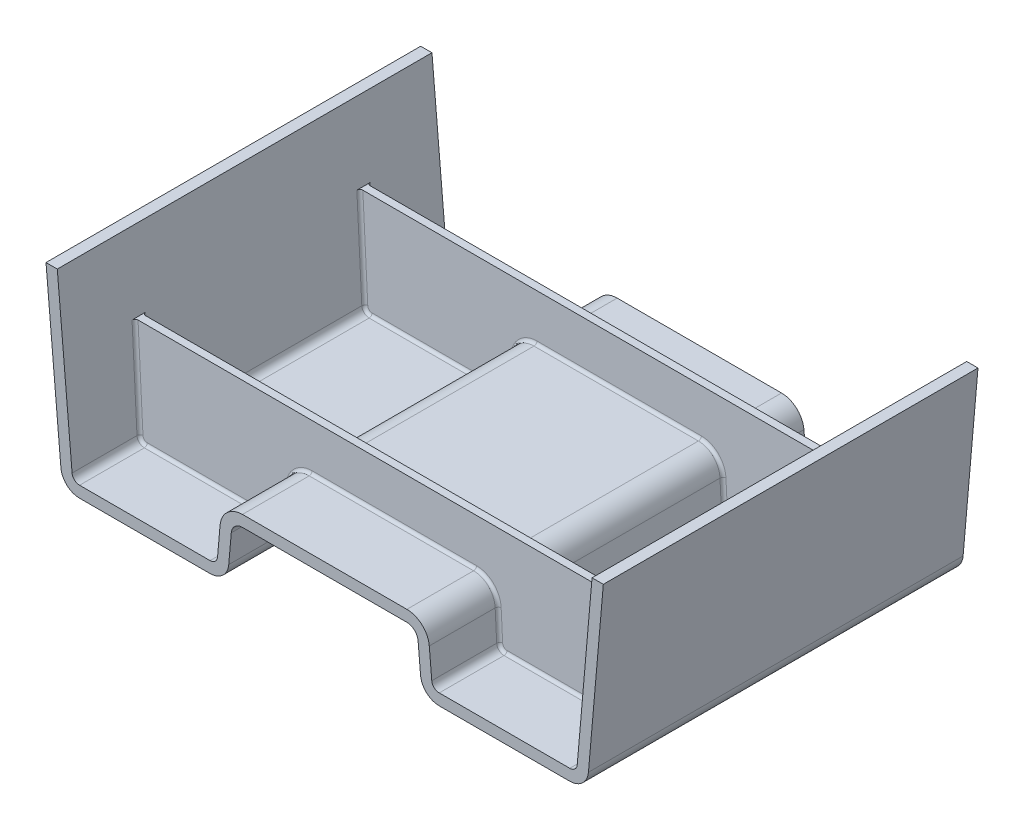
SolidWorks part; units mm, degrees
ref_plane "Front" through (0, 0, 0) normal (0, 0, 1) x (1, 0, 0)
ref_plane "Top" through (0, 0, 0) normal (0, 1, 0) x (1, 0, 0)
ref_plane "Right" through (0, 0, 0) normal (1, 0, 0) x (0, 0, -1)
sketch "Sketch1" plane through (0, 0, 0) normal (0, 0, 1) x (1, 0, 0)
  line L0 (-26, 15) -> (26, 15)
  line L1 (26, 15) -> (26, 0)
  line L2 (26, 0) -> (70, 0)
  line L3 (70, 0) -> (70, 50)
  line L4 (70, 50) -> (-70, 50)
  line L5 (0, 50) -> (0, 0) construction
  line L6 (-70, 0) -> (-70, 50)
  line L7 (-26, 0) -> (-70, 0)
  line L8 (-26, 15) -> (-26, 0)
  point P12 (0, 15)
  dimension "D1" = 50
  dimension "D2" = 140
  dimension "D3" = 52
  dimension "D4" = 15
extrude "Boss-Extrude1" add sketch "Sketch1" along normal mid plane 100
draft "Draft1" type of draft neutral plane draft angle 5 neutral plane "Top" faces to draft 4 parameters "D1"=5
fillet "Fillet1" radius 5 4 edges at (-70, 0, 0) (-26, 0, 0) (26, 0, 0) (70, 0, 0)
fillet "Fillet2" radius 3 2 edges at (24.6877, 15, 0) (-24.6877, 15, 0)
shell "Shell1" thickness 3
ref_plane "Plane1" through (0, 30, 0) normal (0, 1, 0) x (1, 0, 0)
sketch "Sketch2" plane through (0, 30, 0) normal (0, 1, 0) x (1, 0, 0)
  line L0 (-67.4107, -30) -> (67.4107, -30)
  line L1 (-67.4107, 50) -> (-67.4107, -50) construction
  line L2 (67.4107, -50) -> (67.4107, 50) construction
  line L3 (30.5817, -50) -> (65.4183, -50) construction
  dimension "D1" = 20
rib "Rib1" sketch "Sketch2" sketch "Sketch2" thickness 2 extrusion direction normal to sketch draft on yes draft angle 2 parameters "D1"=2, "D3"=2
mirror "Mirror1" about plane through (0, 0, 0) normal (0, 0, 1) of "Rib1"
fillet "Fillet3" radius 0.8 52 edges at (-25.9922, 16.4237, 31.4741) (-25.9922, 16.4237, 28.5259) (-68.512, 17.4128, 28.5604) (68.512, 17.4128, 31.4396) (-66.7695, 3.5254, 28.0755) (-29.2305, 3.5254, 28.0755) (29.2305, 3.5254, 28.0755) (66.7695, 3.5254, 28.0755) (48, 3, 28.0571) (28.2526, 8.6743, 28.2553) (25.9922, 16.4237, 28.5259) (0, 18, 28.581) (-28.2526, 8.6743, 28.2553) (-48, 3, 28.0571) (48, 3, 31.9429) (28.2526, 8.6743, 31.7447) (25.9922, 16.4237, 31.4741) (0, 18, 31.419) (-28.2526, 8.6743, 31.7447) (-48, 3, 31.9429) (66.7695, 3.5254, 31.9245) (-66.7695, 3.5254, 31.9245) (-29.2305, 3.5254, 31.9245) (29.2305, 3.5254, 31.9245) (68.512, 17.4128, 28.5604) (-68.512, 17.4128, 31.4396) (-25.9922, 16.4237, -28.5259) (-25.9922, 16.4237, -31.4741) (-68.512, 17.4128, -31.4396) (68.512, 17.4128, -28.5604) (-66.7695, 3.5254, -31.9245) (-29.2305, 3.5254, -31.9245) (29.2305, 3.5254, -31.9245) (66.7695, 3.5254, -31.9245) (48, 3, -31.9429) (28.2526, 8.6743, -31.7447) (25.9922, 16.4237, -31.4741) (0, 18, -31.419) (-28.2526, 8.6743, -31.7447) (-48, 3, -31.9429) (48, 3, -28.0571) (28.2526, 8.6743, -28.2553) (25.9922, 16.4237, -28.5259) (0, 18, -28.581) (-28.2526, 8.6743, -28.2553) (-48, 3, -28.0571) (66.7695, 3.5254, -28.0755) (-66.7695, 3.5254, -28.0755) (-29.2305, 3.5254, -28.0755) (29.2305, 3.5254, -28.0755) (68.512, 17.4128, -31.4396) (-68.512, 17.4128, -28.5604)
